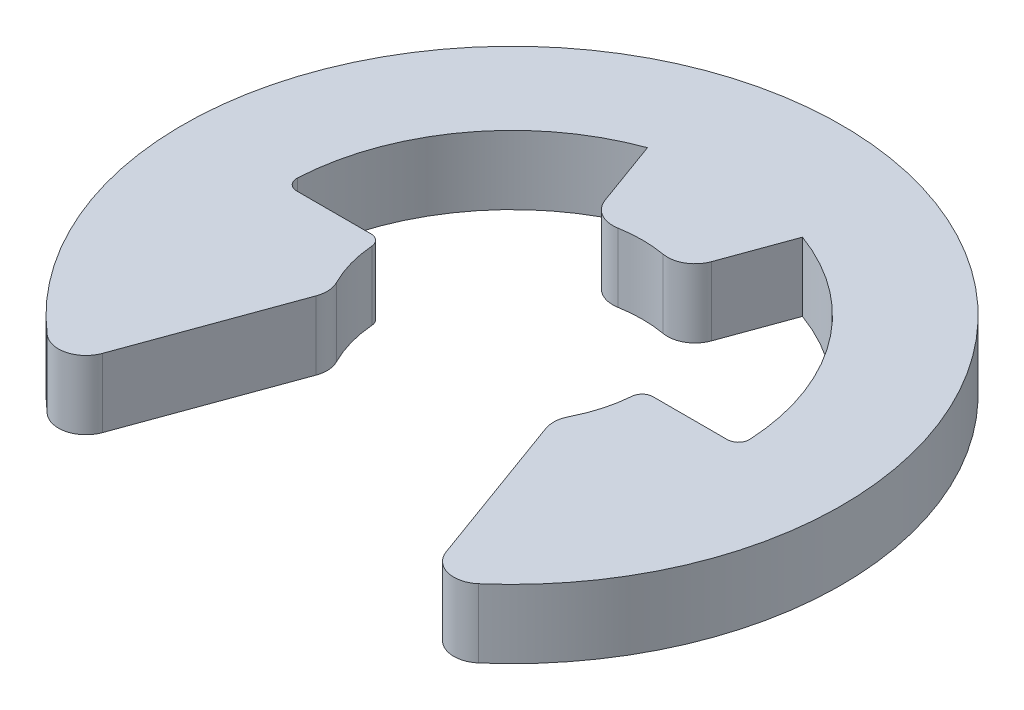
SolidWorks part; units mm, degrees
ref_plane "Front Plane" through (0, 0, 0) normal (0, 0, 1) x (1, 0, 0)
ref_plane "Top Plane" through (0, 0, 0) normal (0, 1, 0) x (1, 0, 0)
ref_plane "Right Plane" through (0, 0, 0) normal (1, 0, 0) x (0, 0, -1)
sketch "Sketch2" plane through (0, 0, 0) normal (0, 1, 0) x (1, 0, 0)
  line L0 (-1.3449, -1.9878) -> (-0.805, -0.5045)
  line L2 (0.805, -0.5045) -> (1.3449, -1.9878)
  line L4 (-0.95, 0) -> (-1.65, 0)
  line L5 (0.95, 0) -> (1.65, 0)
  line L6 (-0.5643, 1.5505) -> (-0.3249, 0.8927)
  line L8 (0.3249, 0.8927) -> (0.5643, 1.5505)
  arc A0 (1.3449, -1.9878) -> (-1.3449, -1.9878) centre (0, 0) ccw
  arc A1 (0.805, -0.5045) -> (0.95, 0) centre (0, 0) ccw
  arc A2 (1.65, 0) -> (0.5643, 1.5505) centre (0, 0) ccw
  arc A3 (-0.95, 0) -> (-0.805, -0.5045) centre (0, 0) ccw
  arc A4 (0.3249, 0.8927) -> (-0.3249, 0.8927) centre (0, 0) ccw
  arc A5 (-0.5643, 1.5505) -> (-1.65, 0) centre (0, 0) ccw
  point P15 (0, 0)
  point P16 (0, 0.95)
  dimension "D1" = 4.8
  dimension "D2" = 1.9
  dimension "D3" = 3.3
  dimension "D4" = 70
  dimension "D5" = 70
  dimension "D6" = 1.61
  dimension "D7" = 40
extrude "Boss-Extrude1" add sketch "Sketch2" along normal mid plane 0.5
fillet "Fillet1" radius 0.2 6 edges at (0.805, 0, 0.5045) (-0.805, 0, 0.5045) (0.3249, 0, -0.8927) (-0.3249, 0, -0.8927) (1.3449, 0, 1.9878) (-1.3449, 0, 1.9878)
fillet "Fillet2" radius 0.08 4 edges at (1.65, 0, 0) (0.95, 0, 0) (-1.65, 0, 0) (-0.95, 0, 0)
